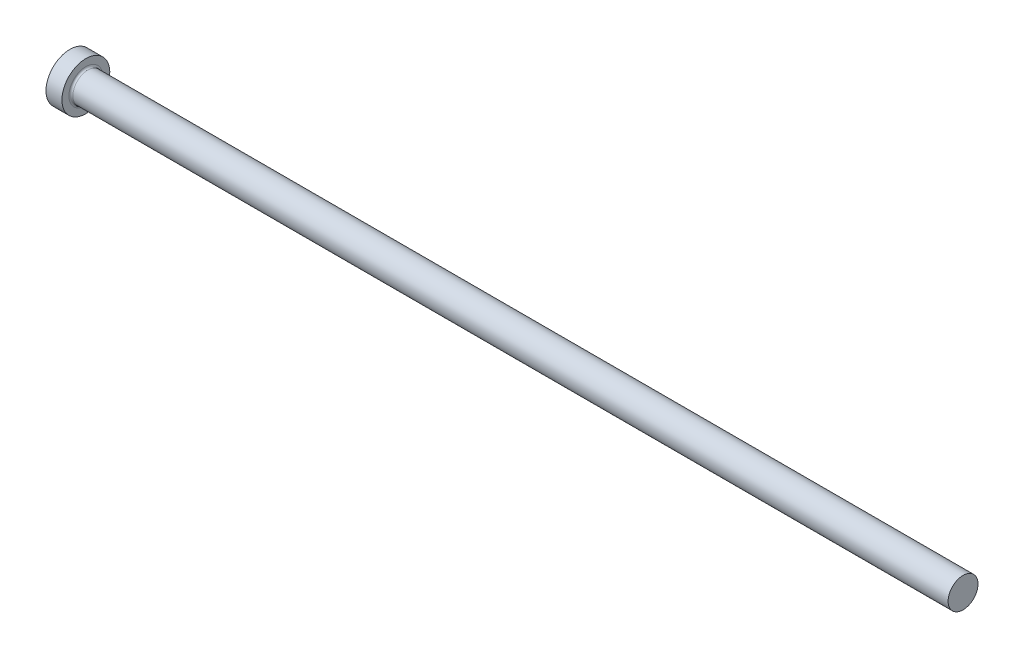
SolidWorks part; units mm, degrees
ref_plane "Front Plane" through (0, 0, 0) normal (0, 0, 1) x (1, 0, 0)
ref_plane "Top Plane" through (0, 0, 0) normal (0, 1, 0) x (1, 0, 0)
ref_plane "Right Plane" through (0, 0, 0) normal (1, 0, 0) x (0, 0, -1)
sketch "Sketch1" plane through (0, 0, 0) normal (0, 0, 1) x (1, 0, 0)
  line L0 (0, 0) -> (0, 9.525)
  line L1 (0, 9.525) -> (6.35, 9.525)
  line L2 (6.35, 9.525) -> (6.35, 6.7399)
  line L3 (7.1374, 5.9525) -> (355.6, 5.9525)
  line L4 (355.6, 5.9525) -> (355.6, 0)
  line L5 (355.6, 0) -> (0, 0)
  line L6 (355.6, 0) -> (0, 0) construction
  line L7 (0, 0) -> (-10.4771, 0) construction
  line L8 (355.6, 0) -> (1002.3976, 0) construction
  arc A0 (7.1374, 5.9525) -> (6.35, 6.7399) centre (7.1374, 6.7399) cw
  dimension "D1" = 0.7874
  dimension "HeadDia" = 19.05
  dimension "HeadThickness" = 6.35
  dimension "PinDia" = 11.905
  dimension "overall" = 355.6
revolve "PIN" add sketch "Sketch1" angle 360 about L6
